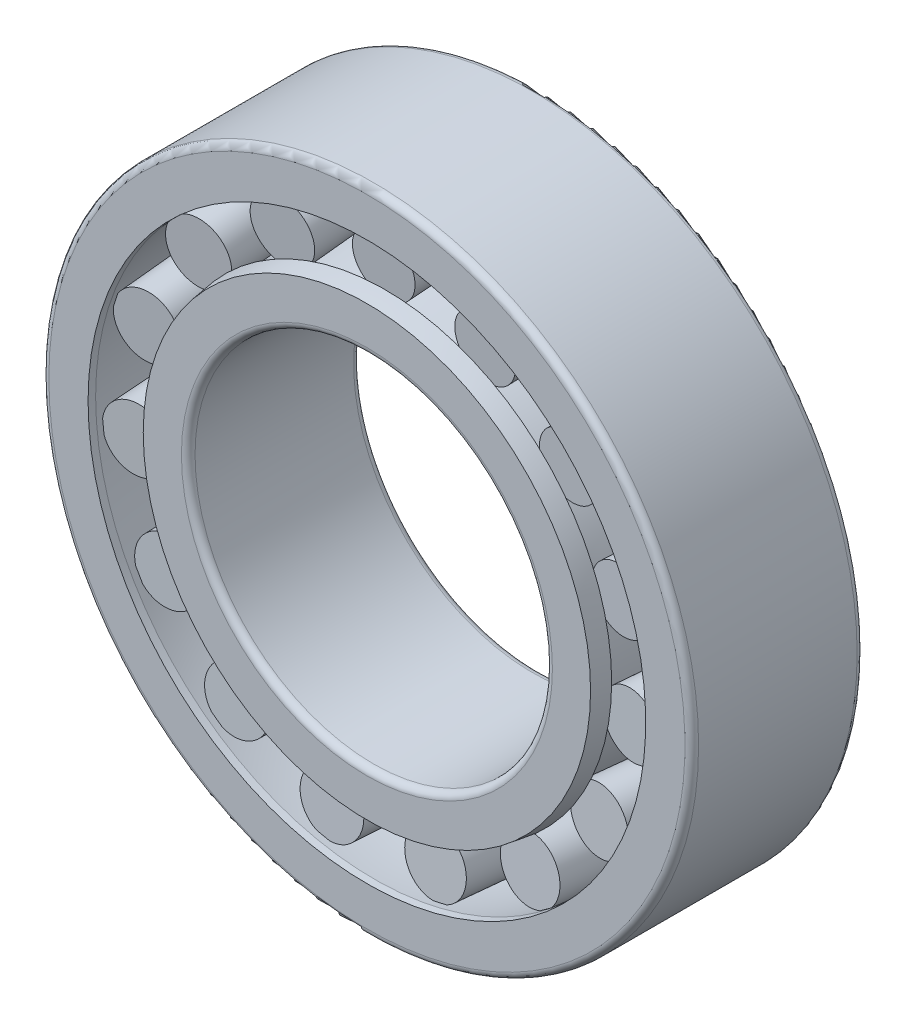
SolidWorks part; units mm, degrees
ref_plane "Front Plane" through (0, 0, 0) normal (0, 0, 1) x (1, 0, 0)
ref_plane "Top Plane" through (0, 0, 0) normal (0, 1, 0) x (1, 0, 0)
ref_plane "Right Plane" through (0, 0, 0) normal (1, 0, 0) x (0, 0, -1)
other "Configuration Table"
sketch "BaseSke" plane through (0, 0, 0) normal (1, 0, 0) x (0, 0, -1)
  line L0 (-47.2296, 0) -> (69.4868, 0) construction
  line L2 (0, 129.5214) -> (0, 87.4749) construction
  line L3 (-26.5, 55) -> (-26.5, 68.8462) construction
  line L4 (-26.5, 100) -> (26.5, 100) construction
  line L5 (-26.5, 55) -> (26.5, 55) construction
  line L7 (26.5, 55) -> (26.5, 68.8462) construction
  line L8 (26.5, 85.4615) -> (26.5, 100) construction
  line L9 (-26.5, 85.4615) -> (-26.5, 100) construction
  line L11 (0, 79.2725) -> (-26.5, 77.1538) construction
  line L12 (0, 79.2725) -> (26.5, 77.1538) construction
  line L13 (-26.5, 85.4615) -> (-26.5, 68.8462) construction
  line L14 (0, 71.07) -> (0, -86.3012) construction
  line L15 (0, 87.4749) -> (0, 71.07) construction
  line L16 (-21.3169, 76.6821) -> (-20.5504, 67.0951) construction
  line L17 (-22.0833, 86.269) -> (-4.4729, 87.677)
  line L18 (-22.0833, 86.269) -> (-21.3169, 76.6821)
  line L19 (-20.5504, 67.0951) -> (-2.9399, 68.503) construction
  line L20 (-4.4729, 87.677) -> (-3.7064, 78.09)
  line L21 (-2.9399, 68.503) -> (-3.7064, 78.09) construction
  line L22 (-21.3169, 76.6821) -> (-3.7064, 78.09)
  line L23 (-26.5, 76.2677) -> (0, 78.3863) construction
  arc A1 (-26.5, 85.4615) -> (26.5, 85.4615) centre (0, -87.93) cw construction
  arc A2 (26.5, 68.8462) -> (-26.5, 68.8462) centre (0, -87.93) ccw construction
revolve "Roller" add sketch "BaseSke" angle 360 about L23
sketch "OuterRaceSke" plane through (0, 0, 0) normal (1, 0, 0) x (0, 0, -1)
  line L0 (0, 0) -> (0, 94.5438) construction
  line L1 (-26.5, 100) -> (26.5, 100)
  line L2 (-26.5, 100) -> (-26.5, 85.4413)
  line L3 (26.5, 100) -> (26.5, 85.4413)
  line L5 (-50.3916, 0) -> (55.2197, 0) construction
  arc A0 (-26.5, 85.4413) -> (26.5, 85.4413) centre (0, -87.93) cw
  arc A2 (26.5, 85.4615) -> (-26.5, 85.4615) centre (0, -87.93) ccw construction
  dimension "D1" = 0.02
revolve "OuterRace" add sketch "OuterRaceSke" angle 360 about L5
sketch "InnerRaceSke" plane through (0, 0, 0) normal (1, 0, 0) x (0, 0, -1)
  line L0 (-70.8626, 0) -> (113.5527, 0) construction
  line L1 (0, 90.393) -> (0, -90.393) construction
  line L2 (-26.5, 55) -> (26.5, 55)
  line L3 (-26.5, 55) -> (-26.5, 68.8462)
  line L4 (-20.8587, 69.6959) -> (-20.6517, 67.1071)
  line L5 (-20.6517, 67.1071) -> (-2.8419, 68.5309)
  line L7 (-2.8419, 68.5309) -> (-3.0425, 71.0409)
  line L8 (-21.3169, 76.6821) -> (-20.5504, 67.0951) construction
  line L9 (2.8419, 68.5309) -> (3.0425, 71.0409)
  line L10 (-2.9399, 68.503) -> (-3.7064, 78.09) construction
  line L11 (-20.5504, 67.0951) -> (-2.9399, 68.503) construction
  line L14 (20.6517, 67.1071) -> (2.8419, 68.5309)
  line L15 (20.8587, 69.6959) -> (20.6517, 67.1071)
  line L16 (26.5, 55) -> (26.5, 68.8462)
  arc A0 (-26.5, 68.8462) -> (-20.8587, 69.6959) centre (0, -87.93) cw
  arc A1 (26.5, 68.8462) -> (-26.5, 68.8462) centre (0, -87.93) ccw construction
  arc A2 (-3.0425, 71.0409) -> (3.0425, 71.0409) centre (0, -87.93) cw
  arc A3 (26.5, 68.8462) -> (20.8587, 69.6959) centre (0, -87.93) ccw
  point P38 (0, 55)
  dimension "D2" = 0.1
  dimension "D1" = 0.02
  dimension "D3" = 0.1
revolve "InnerRace" add sketch "InnerRaceSke" angle 360 about L0
mirror "MirrorRoller" about plane through (0, 0, 0) normal (0, 0, 1) of "Roller"
fillet "Fillet1" radius 2.1 4 edges at (55, 0, 26.5) (100, 0, 26.5) (55, 0, -26.5) (100, 0, -26.5)
sketch "CutGrooveSke" plane through (0, 0, 0) normal (1, 0, 0) x (0, 0, -1)
  line L0 (-51.8407, 0) -> (83.8302, 0) construction
  line L1 (-13.25, -118) -> (-15.9, -118)
  line L2 (-13.25, -118) -> (-13.25, -98)
  line L3 (-13.25, -98) -> (-15.9, -98)
  line L4 (-15.9, -118) -> (-15.9, -98)
revolve "CutGroove" [suppressed] cut sketch "CutGrooveSke" angle 360 about L0
sketch "TaperSke" plane through (0, 0, 0) normal (1, 0, 0) x (0, 0, -1)
  line L0 (-26.5, 55) -> (26.5, 55)
  line L1 (26.5, 55) -> (26.5, 59.4167)
  line L2 (26.5, 59.4167) -> (-26.5, 55)
  line L7 (-41.2502, 0) -> (40.8606, 0) construction
revolve "Taper" [suppressed] cut sketch "TaperSke" angle 360 about L7
fillet "Fillet2" [suppressed] radius 2.1
pattern_circular "CirPatternBall" count 15 over 360 about axis through (0, 0, 0) along (0, 0, 1) of "Roller", "MirrorRoller"
sketch "SimplifiedSke" plane through (0, 0, 0) normal (1, 0, 0) x (0, 0, -1)
  line L0 (37.5911, 0) -> (-37.5911, 0) construction
  line L1 (0, 0) -> (0, 96.8272) construction
  line L2 (-20.5504, 67.0951) -> (-2.9399, 68.503)
  line L3 (-20.5504, 67.0951) -> (-22.0833, 86.269)
  line L4 (-22.0833, 86.269) -> (-4.4729, 87.677)
  line L5 (-2.9399, 68.503) -> (-4.4729, 87.677)
  line L7 (2.9399, 68.503) -> (4.4729, 87.677)
  line L8 (20.5504, 67.0951) -> (2.9399, 68.503)
  line L9 (20.5504, 67.0951) -> (22.0833, 86.269)
  line L10 (22.0833, 86.269) -> (4.4729, 87.677)
revolve "Simplified" [suppressed] add sketch "SimplifiedSke" angle 360 about L0
chamfer "Chamfer" distance 2.2083 angle 10 2 edges at (85.4413, 0, -26.5) (85.4413, 0, 26.5)
equation "\"D1@BaseSke\" = \"Bearing_Thickness@BaseSke\"*3"
equation "\"D2@BaseSke\" =  ( \"Bearing_Outside_Diameter@BaseSke\" - \"Bearing_Inside_Diameter@BaseSke\" ) /6.5"
equation "\"D3@BaseSke\" = \"D2@BaseSke\"*1.05"
equation "\"D4@BaseSke\" = \"Bearing_Thickness@BaseSke\"/3"
equation "\"D5@BaseSke\" = \"Bearing_Thickness@BaseSke\"/12"
equation "\"D6@BaseSke\" = \"Bearing_Thickness@BaseSke\"/60"
equation "\"D1@CutGrooveSke\" = \"Bearing_Outside_Diameter@BaseSke\" * 0.49"
equation "\"D2@CutGrooveSke\" = \"Bearing_Thickness@BaseSke\" *0.25"
equation "\"D3@CutGrooveSke\" = \"Bearing_Thickness@BaseSke\"/20"
equation "\"Taper@TaperSke\" = \"Bearing_Thickness@BaseSke\"/12"
equation "\"D1@Fillet2\" = \"Fillet_radius@Fillet1\""
equation "\"D1@CirPatternBall\" =  int(  ( \"Bearing_Outside_Diameter@BaseSke\" + \"Bearing_Inside_Diameter@BaseSke\" )  / 2 *  pi  /  ( \"Bearing_Outside_Diameter@BaseSke\" - \"Bearing_Inside_Diameter@BaseSke\" ) * 2.8 "
equation "\"D1@Chamfer\" = \"Bearing_Thickness@BaseSke\"/24"
